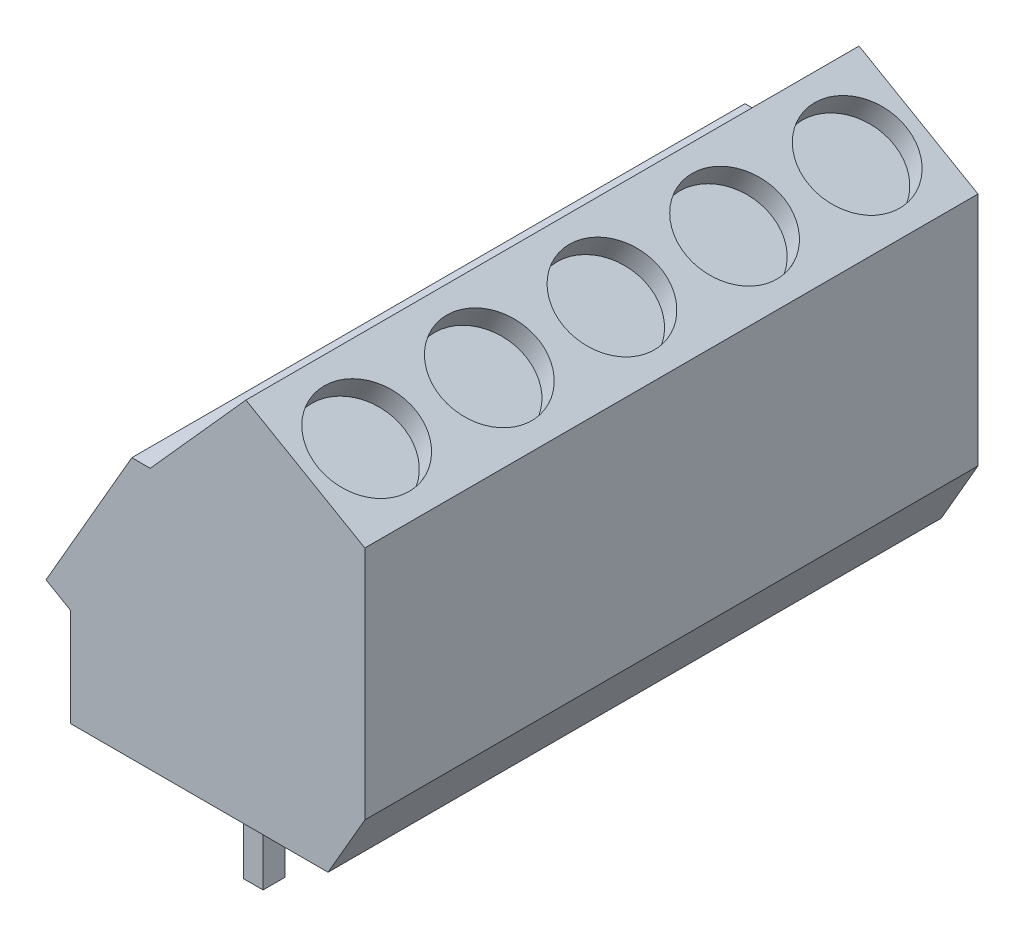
SolidWorks part; units mm, degrees
ref_plane "Plane1" through (0, 0, 0) normal (0, 0, 1) x (1, 0, 0)
ref_plane "Plane2" through (0, 0, 0) normal (0, 1, 0) x (1, 0, 0)
ref_plane "Plane3" through (0, 0, 0) normal (1, 0, 0) x (0, 0, -1)
sketch "Sketch1" plane through (0, 0, 0) normal (0, 0, 1) x (1, 0, 0)
  line L0 (-12, 0) -> (-1.5, 0)
  line L1 (-1.5, 0) -> (0, 2.5981)
  line L2 (0, 2.5981) -> (0, 12.2)
  line L3 (0, 12.2) -> (-4.8497, 15)
  line L4 (-4.8497, 15) -> (-8.75, 10.6395)
  line L5 (-8.75, 10.6395) -> (-9.5, 10.6395)
  line L6 (-9.5, 10.6395) -> (-13, 4.5774)
  line L7 (-13, 4.5774) -> (-12, 4)
  line L8 (-12, 4) -> (-12, 0)
  point P10 (0, 0)
  dimension "D1" = 1.5
  dimension "D2" = 60
  dimension "D3" = 13
  dimension "D4" = 15
  dimension "D5" = 5.6
  dimension "D6" = 4
  dimension "D7" = 12
  dimension "D8" = 7
  dimension "D9" = 60
  dimension "D10" = 0.75
  dimension "D11" = 12.248
extrude "Base-Extrude" add sketch "Sketch1" along normal blind 25
sketch "Sketch2" plane through (-11.7321, 6.7735, 0) normal (-0.866, 0.5, 0) x (0, 0, 1)
  line L0 (2.5, 2.4641) -> (2.5, -3.2403) construction
  line L1 (0, 4.4641) -> (0, -2.5359) construction
  line L2 (25, -2.5359) -> (0, -2.5359) construction
  line L3 (1.2, 2.4641) -> (3.8, 2.4641)
  line L4 (1.2, 2.4641) -> (1.2, -0.5359)
  line L5 (1.2, -0.5359) -> (3.8, -0.5359)
  line L6 (3.8, 2.4641) -> (3.8, -0.5359)
  dimension "D1" = 2.5
  dimension "D2" = 2.6
  dimension "D3" = 3
  dimension "D4" = 2
extrude "Cut-Extrude1" cut sketch "Sketch2" against normal blind 5
chamfer "Chamfer1" distance 1.5 angle 45 1 edges at (-10.5, 8.9075, 2.5)
chamfer "Chamfer2" distance 0.5 angle 45 3 edges at (-10.875, 8.258, 1.2) (-12, 6.3094, 2.5) (-10.875, 8.258, 3.8)
pattern_linear "LPattern1" count 5 spacing 5 along (0, 0, 1) of "Chamfer2", "Chamfer1", "Cut-Extrude1"
sketch "Sketch3" plane through (5.2828, 9.15, 0) normal (0.5, 0.866, 0) x (-0.866, 0.5, 0)
  line L0 (11.7, 2.5) -> (6.1, 2.5) construction
  line L1 (6.1, 0) -> (11.7, 0) construction
  line L2 (11.7, 25) -> (11.7, 0) construction
  line L3 (6.1, 25) -> (6.1, 0) construction
  line L4 (8.9, 2.5) -> (8.9, 7.5) construction
  circle A0 centre (8.9, 2.5) radius 2
  circle A1 centre (8.9, 7.5) radius 2
  circle A2 centre (8.9, 12.5) radius 2
  circle A3 centre (8.9, 17.5) radius 2
  circle A4 centre (8.9, 22.5) radius 2
  dimension "D2" = 4
  dimension "D1" = 2.5
  dimension "D3" = 5
extrude "Cut-Extrude3" cut sketch "Sketch3" against normal blind 1
sketch "Sketch4" plane through (0, 0, 0) normal (0, -1, 0) x (1, 0, 0)
  line L0 (-6.6, 2.95) -> (-6.6, 2.05) construction
  line L1 (-7, 2.5) -> (-6.2, 2.5) construction
  line L2 (-12, 0) -> (-1.5, 0) construction
  line L3 (-7, 2.95) -> (-6.2, 2.95)
  line L4 (-7, 2.95) -> (-7, 2.05)
  line L5 (-7, 2.05) -> (-6.2, 2.05)
  line L6 (-6.2, 2.95) -> (-6.2, 2.05)
  line L7 (0, 25) -> (0, 0) construction
  line L8 (-7, 7.95) -> (-6.2, 7.95)
  line L9 (-7, 7.95) -> (-7, 7.05)
  line L10 (-7, 7.05) -> (-6.2, 7.05)
  line L11 (-6.2, 7.95) -> (-6.2, 7.05)
  line L12 (-6.6, 7.95) -> (-6.6, 7.05) construction
  line L13 (-7, 7.5) -> (-6.2, 7.5) construction
  line L14 (-7, 12.95) -> (-6.2, 12.95)
  line L15 (-7, 12.95) -> (-7, 12.05)
  line L16 (-7, 12.05) -> (-6.2, 12.05)
  line L17 (-6.2, 12.95) -> (-6.2, 12.05)
  line L18 (-6.6, 12.95) -> (-6.6, 12.05) construction
  line L19 (-7, 12.5) -> (-6.2, 12.5) construction
  line L20 (-7, 17.95) -> (-6.2, 17.95)
  line L21 (-7, 17.95) -> (-7, 17.05)
  line L22 (-7, 17.05) -> (-6.2, 17.05)
  line L23 (-6.2, 17.95) -> (-6.2, 17.05)
  line L24 (-6.6, 17.95) -> (-6.6, 17.05) construction
  line L25 (-7, 17.5) -> (-6.2, 17.5) construction
  line L26 (-7, 22.95) -> (-6.2, 22.95)
  line L27 (-7, 22.95) -> (-7, 22.05)
  line L28 (-7, 22.05) -> (-6.2, 22.05)
  line L29 (-6.2, 22.95) -> (-6.2, 22.05)
  line L30 (-6.6, 22.95) -> (-6.6, 22.05) construction
  line L31 (-7, 22.5) -> (-6.2, 22.5) construction
  line L32 (-7, 2.95) -> (-7, 7.95) construction
  dimension "D1" = 0.8
  dimension "D2" = 0.9
  dimension "D3" = 2.5
  dimension "D4" = 6.6
  dimension "D5" = 5
extrude "Boss-Extrude1" add sketch "Sketch4" along normal blind 4
